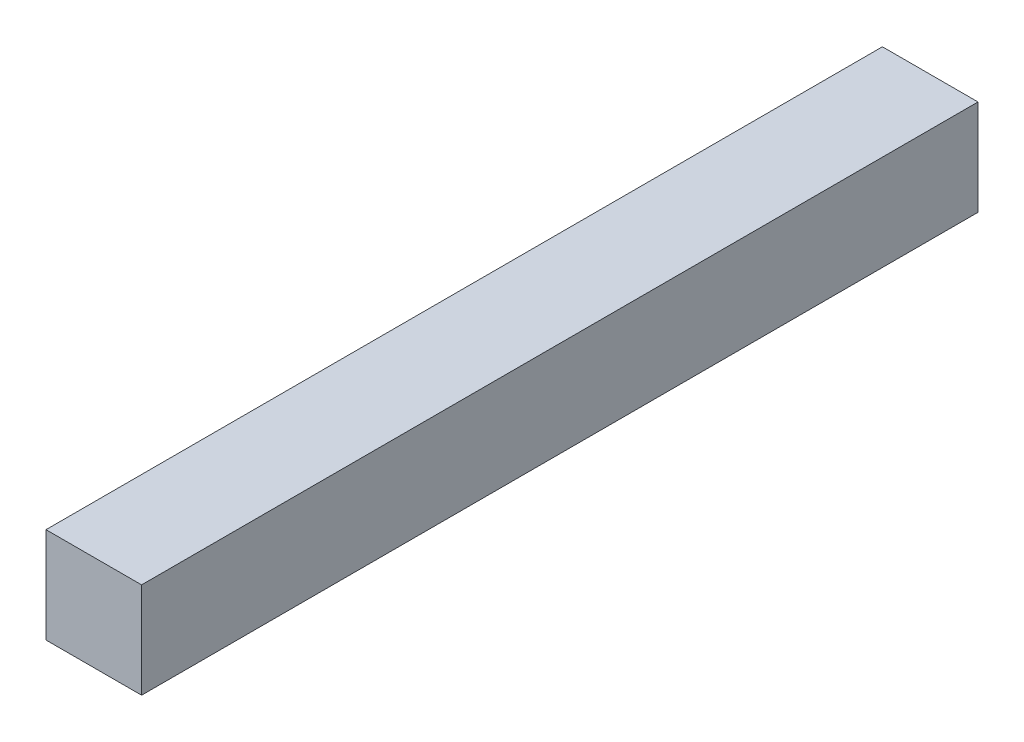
SolidWorks part; units mm, degrees
ref_plane "Front Plane" through (0, 0, 0) normal (0, 0, 1) x (1, 0, 0)
ref_plane "Top Plane" through (0, 0, 0) normal (0, 1, 0) x (1, 0, 0)
ref_plane "Right Plane" through (0, 0, 0) normal (1, 0, 0) x (0, 0, -1)
sketch "Sketch1" plane through (0, 0, 0) normal (0, 0, 1) x (1, 0, 0)
  line L1 (40, 40) -> (-40, 40)
  line L2 (40, 40) -> (40, -40)
  line L3 (40, -40) -> (-40, -40)
  line L4 (-40, 40) -> (-40, -40)
  line L5 (40, 40) -> (-40, -40) construction
  line L6 (40, -40) -> (-40, 40) construction
  point P0 (0, 0)
  dimension "D1" = 80
  dimension "D2" = 80
extrude "Boss-Extrude1" add sketch "Sketch1" along normal mid plane 700
sketch "Sketch2" plane through (0, 0, -350) normal (0, 0, -1) x (-1, 0, 0)
  circle A0 centre (0, 0) radius 30
  dimension "D1" = 60
extrude "Cut-Extrude1" cut sketch "Sketch2" against normal blind 10
sketch "Sketch3" plane through (0, 0, -340) normal (0, 0, -1) x (-1, 0, 0)
  circle A2 centre (0, 0) radius 35
  circle A3 centre (0, 0) radius 35
  dimension "D1" = 5
extrude "Cut-Extrude2" cut sketch "Sketch3" against normal blind 10
